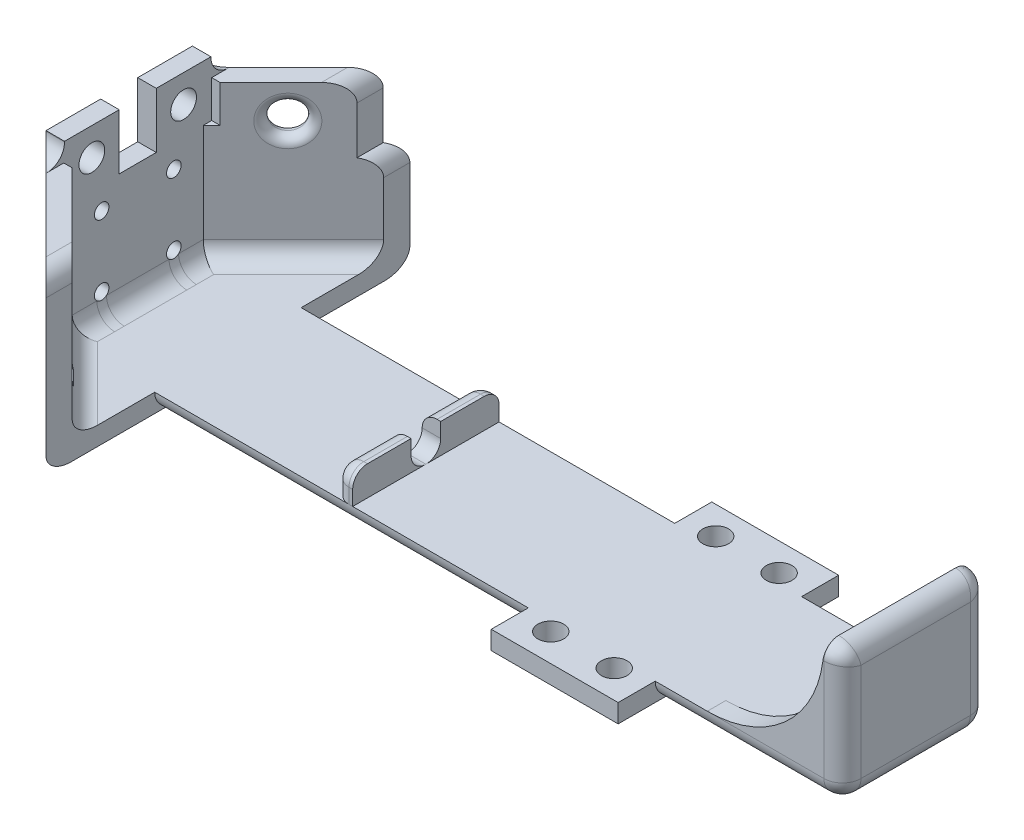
SolidWorks part; units mm, degrees
ref_plane "Front Plane" through (0, 0, 0) normal (0, 0, 1) x (1, 0, 0)
ref_plane "Top Plane" through (0, 0, 0) normal (0, 1, 0) x (1, 0, 0)
ref_plane "Right Plane" through (0, 0, 0) normal (1, 0, 0) x (0, 0, -1)
sketch "Sketch1" plane through (0, 0, 0) normal (0, 1, 0) x (1, 0, 0)
  line L1 (-68.2538, 12.5476) -> (68.2538, 12.5476)
  line L2 (-68.2538, 12.5476) -> (-68.2538, -12.5476)
  line L3 (-68.2538, -12.5476) -> (68.2538, -12.5476)
  line L4 (68.2538, 12.5476) -> (68.2538, -12.5476)
  line L5 (-68.2538, 12.5476) -> (68.2538, -12.5476) construction
  line L6 (-68.2538, -12.5476) -> (68.2538, 12.5476) construction
  point P0 (0, 0)
  dimension "D1" = 136.5076
  dimension "D2" = 25.0952
extrude "Boss-Extrude1" add sketch "Sketch1" along normal blind 3.175 contours L1 L4 L3 L2
sketch "Sketch5" plane through (0, 3.175, 0) normal (0, 1, 0) x (1, 0, 0)
  line L0 (-68.2538, 12.5476) -> (68.2538, 12.5476) construction
  line L1 (-68.2538, -12.5476) -> (-65.0788, -12.5476)
  line L2 (-68.2538, -12.5476) -> (-68.2538, 12.5476)
  line L3 (-68.2538, 12.5476) -> (-65.0788, 12.5476)
  line L4 (-65.0788, -12.5476) -> (-65.0788, 12.5476)
  dimension "D1" = 3.175
extrude "Boss-Extrude2" add sketch "Sketch5" along normal blind 19.9898
mirror "Mirror1" about plane through (0, 0, 0) normal (1, 0, 0) of "Boss-Extrude2"
sketch "Sketch6" plane through (-68.2538, 0, 0) normal (-1, 0, 0) x (0, 0, 1)
  line L0 (-12.5476, 23.1648) -> (12.5476, 23.1648) construction
  line L1 (-12.5476, 23.1648) -> (-12.5476, 0) construction
  line L2 (12.5476, 23.1648) -> (12.5476, 0) construction
  circle A0 centre (-6.1849, 19.1648) radius 1.2497
  circle A1 centre (6.1849, 19.1648) radius 1.2497
  circle A2 centre (6.1849, 7.1648) radius 1.2497
  circle A3 centre (-6.1849, 7.1648) radius 1.2497
  dimension "D9" = 2.4994
  dimension "D3" = 4
  dimension "D4" = 4
  dimension "D5" = 6.3627
  dimension "D6" = 6.3627
  dimension "D7" = 6.3627
  dimension "D8" = 12
  dimension "D1" = 2
  dimension "D2" = 2
extrude "Cut-Extrude1" cut sketch "Sketch6" against normal up to next
sketch "Sketch8" plane through (0, 0, 12.5476) normal (0, 0, 1) x (1, 0, 0)
  line L0 (68.2538, 19.7891) -> (25.2846, 19.7891) construction
  line L1 (68.2538, 23.1648) -> (68.2538, 0) construction
  line L2 (25.2846, 0) -> (25.2846, 19.7891) construction
  line L3 (-68.2538, 0) -> (68.2538, 0) construction
  dimension "D1" = 42.9692
  dimension "D2" = 19.7891
sketch "Sketch9" plane through (0, 0, -12.5476) normal (0, 0, -1) x (-1, 0, 0)
  line L0 (-68.2538, 19.7891) -> (-25.2846, 19.7891) construction
  line L1 (-25.2846, 0) -> (-25.2846, 19.7891) construction
  line L2 (-68.2538, 19.7891) -> (-25.2846, 19.7891) construction
  line L3 (-25.2846, 0) -> (-25.2846, 19.7891) construction
sketch "Sketch10" plane through (0, 0, 12.5476) normal (0, 0, 1) x (1, 0, 0)
  line L0 (-68.2538, 0) -> (68.2538, 0) construction
  line L1 (14.4096, 0) -> (36.1596, 0)
  line L2 (14.4096, 0) -> (14.4096, 3.175)
  line L3 (14.4096, 3.175) -> (36.1596, 3.175)
  line L4 (36.1596, 0) -> (36.1596, 3.175)
  line L5 (-65.0788, 3.175) -> (65.0788, 3.175) construction
  point P8 (25.2846, 0)
  dimension "D1" = 21.75
ref_plane "Plane1" through (0, 0, 0) normal (0, 0, 1) x (1, 0, 0)
extrude "Boss-Extrude5" add sketch "Sketch10" along normal blind 6.35
sketch "Sketch13" plane through (0, 3.175, 0) normal (0, 1, 0) x (1, 0, 0)
  line L0 (36.1596, -18.8976) -> (14.4096, -18.8976) construction
  line L1 (14.4096, -18.8976) -> (14.4096, -12.5476) construction
  circle A0 centre (19.8471, -14.1351) radius 2.2098
  circle A1 centre (30.7221, -14.1351) radius 2.2098
extrude "Cut-Extrude3" cut sketch "Sketch13" against normal through all
mirror "Mirror4" about plane through (0, 0, 0) normal (0, 0, 1) of "Boss-Extrude5", "Cut-Extrude3"
sketch "Sketch16" plane through (0, 0, -12.5476) normal (0, 0, -1) x (-1, 0, 0)
  line L0 (-36.1596, 3.175) -> (-65.0788, 3.175) construction
  line L1 (-65.0788, 23.1648) -> (-65.0788, 3.175) construction
  line L2 (-45.089, 3.175) -> (-65.0788, 3.175)
  line L3 (-65.0788, 23.1648) -> (-65.0788, 3.175)
  arc A0 (-65.0788, 23.1648) -> (-45.089, 3.175) centre (-45.089, 23.1648) ccw
extrude "Boss-Extrude6" add sketch "Sketch16" against normal blind 3.175
mirror "Mirror5" about plane through (0, 0, 0) normal (0, 0, 1) of "Boss-Extrude6"
sketch "Sketch17" plane through (0, 3.175, 0) normal (0, 1, 0) x (1, 0, 0)
  line L0 (-65.0788, -12.5476) -> (14.4096, -12.5476) construction
  line L1 (-15.6912, -12.5476) -> (-18.8662, -12.5476)
  line L2 (-15.6912, -12.5476) -> (-15.6912, -2.54)
  line L3 (-15.6912, 12.5476) -> (-18.8662, 12.5476)
  line L4 (-18.8662, -12.5476) -> (-18.8662, -2.54)
  line L5 (-65.0788, 12.5476) -> (14.4096, 12.5476) construction
  line L6 (-18.8662, 2.54) -> (-18.8662, 12.5476)
  line L7 (-18.8662, -2.54) -> (-15.6912, -2.54)
  line L9 (-18.8662, 2.54) -> (-15.6912, 2.54)
  line L11 (-15.6912, 2.54) -> (-15.6912, 12.5476)
  dimension "D1" = 3.175
  dimension "D2" = 80.77
  dimension "D3" = 5.08
extrude "Boss-Extrude7" add sketch "Sketch17" along normal blind 5.08 contours L6 L3 L11 L9 | L4 L7 L2 L1
fillet "Fillet3" radius 2.54 10 edges at (66.6663, 23.1648, -12.5476) (66.6663, 23.1648, 12.5476) (-17.2787, 8.255, 12.5476) (-17.2787, 3.175, -2.54) (-17.2787, 3.175, 2.54) (-17.2787, 8.255, -12.5476) (-18.8662, 5.715, -12.5476) (-18.8662, 5.715, 12.5476) (-18.8662, 8.255, -7.5438) (-18.8662, 8.255, 7.5438)
sketch "Sketch18" plane through (0, 23.1648, 0) normal (0, 1, 0) x (1, 0, 0)
  line L0 (-68.2538, 12.5476) -> (-68.2538, -12.5476) construction
  line L1 (-65.0788, 12.5476) -> (-68.2538, 12.5476)
  line L2 (-65.0788, 12.5476) -> (-65.0788, 3.175)
  line L3 (-65.0788, 3.175) -> (-68.2538, 3.175)
  line L4 (-68.2538, 12.5476) -> (-68.2538, 3.175)
  line L6 (-65.0788, -12.5476) -> (-68.2538, -12.5476)
  line L7 (-65.0788, -12.5476) -> (-65.0788, -3.175)
  line L8 (-65.0788, -3.175) -> (-68.2538, -3.175)
  line L9 (-68.2538, -12.5476) -> (-68.2538, -3.175)
  point P12 (-66.6663, -3.175)
  dimension "D1" = 6.35
extrude "Boss-Extrude8" add sketch "Sketch18" along normal blind 9.525
sketch "Sketch19" plane through (-68.2538, 0, 0) normal (-1, 0, 0) x (0, 0, 1)
  line L0 (-3.175, 32.6898) -> (-3.175, 23.1648) construction
  line L1 (-12.5476, 32.6898) -> (-3.175, 32.6898) construction
  line L2 (3.175, 32.6898) -> (12.5476, 32.6898) construction
  circle A0 centre (-7.8613, 27.9273) radius 2.2098
  circle A1 centre (7.8613, 27.9273) radius 2.2098
  point P7 (-3.175, 27.9273)
  point P11 (-7.8613, 32.6898)
  point P15 (7.8613, 32.6898)
  dimension "D1" = 4.4196
extrude "Cut-Extrude4" cut sketch "Sketch19" against normal up to next
sketch "Sketch22" plane through (0, 0, 0) normal (0, -1, 0) x (1, 0, 0)
  line L0 (-68.2538, -12.5476) -> (-49.6187, -31.1827)
  line L1 (-49.6187, -31.1827) -> (-49.6187, -12.5476)
  line L2 (-68.2538, -12.5476) -> (14.4096, -12.5476) construction
  line L3 (-68.2538, -12.5476) -> (-49.6187, -12.5476)
  dimension "D1" = 26.354
extrude "Boss-Extrude9" add sketch "Sketch22" against normal blind 3.175
sketch "Sketch24" plane through (0, 3.175, 0) normal (0, 1, 0) x (1, 0, 0)
  line L0 (-68.2538, 12.5476) -> (-49.6187, 31.1827) construction
  line L1 (-68.2538, 12.5476) -> (-49.6187, 31.1827)
  line L2 (-65.0788, 11.2325) -> (-49.6187, 26.6926)
  line L3 (-49.6187, 31.1827) -> (-49.6187, 12.5476) construction
  line L4 (-65.0788, 12.5476) -> (-68.2538, 12.5476) construction
  line L5 (-65.0788, -12.5476) -> (-65.0788, 12.5476) construction
  line L6 (-49.6187, 31.1827) -> (-49.6187, 26.6926)
  line L7 (-65.0788, 12.5476) -> (-68.2538, 12.5476)
  line L8 (-65.0788, 11.2325) -> (-65.0788, 12.5476)
  line L9 (-66.0087, 10.3025) -> (-47.3736, 28.9376) construction
  dimension "D1" = 3.175
extrude "Boss-Extrude10" add sketch "Sketch24" along normal blind 26.354
sketch "Sketch29" plane through (0, 29.529, 0) normal (0, 1, 0) x (1, 0, 0)
  line L0 (-65.0788, 12.5476) -> (-63.7637, 12.5476)
  line L5 (-68.2538, 12.5476) -> (-65.0788, 12.5476)
  line L6 (-65.0788, 12.5476) -> (-65.0788, 11.2325)
  line L7 (-65.0788, 11.2325) -> (-49.6187, 26.6926)
  line L8 (-49.6187, 26.6926) -> (-49.6187, 31.1827)
  line L9 (-49.6187, 31.1827) -> (-68.2538, 12.5476)
  line L11 (-65.0788, 12.5476) -> (-65.0788, 11.2325)
  line L12 (-65.0788, 11.2325) -> (-63.7637, 12.5476)
  dimension "D1" = 0
extrude "Cut-Extrude7" cut sketch "Sketch29" against normal up to surface (6.3642 mm away)
mirror "Mirror6" about plane through (0, 0, 0) normal (0, 0, 1) of "Cut-Extrude7", "Boss-Extrude10", "Boss-Extrude9"
sketch "Sketch27" plane through (-40.4007, 0, 40.4007) normal (-0.7071, 0, 0.7071) x (0.7071, 0, 0.7071)
  line L0 (-13.0362, 29.529) -> (-39.3902, 29.529) construction
  line L1 (-16.2112, 29.529) -> (-16.2112, 3.175) construction
  line L2 (-36.1515, 15.225) -> (-37.4055, 15.225)
  line L4 (-36.1515, 17.479) -> (-37.4055, 17.479)
  line L5 (-37.4055, 15.225) -> (-37.4055, 17.479)
  line L6 (-28.0402, 26.1857) -> (-28.0402, 27.354)
  line L7 (-28.0402, 27.354) -> (-24.3862, 27.354)
  line L8 (-24.3862, 26.1857) -> (-24.3862, 27.354)
  line L10 (-28.0402, 6.5183) -> (-28.0402, 5.35)
  line L11 (-28.0402, 5.35) -> (-24.3862, 5.35)
  line L12 (-24.3862, 6.5183) -> (-24.3862, 5.35)
  arc A0 (-36.1515, 15.225) -> (-28.0402, 6.5183) centre (-26.2132, 16.352) ccw
  circle A1 centre (-26.2132, 16.352) radius 11.002 construction
  arc A2 (-28.0402, 26.1857) -> (-36.1515, 17.479) centre (-26.2132, 16.352) ccw
  arc A3 (-24.3862, 6.5183) -> (-24.3862, 26.1857) centre (-26.2132, 16.352) ccw
  point P5 (-26.2132, 29.529)
  point P23 (-16.2112, 16.352)
extrude "Cut-Extrude6" cut sketch "Sketch27" against normal up to next
sketch "Sketch30" plane through (0, 29.529, 0) normal (0, 1, 0) x (1, 0, 0)
  line L0 (-51.9047, 24.4066) -> (-51.9047, 28.8967)
  line L5 (-65.0788, 12.5476) -> (-63.7637, 12.5476)
  line L6 (-63.7637, 12.5476) -> (-49.6187, 26.6926)
  line L7 (-49.6187, 26.6926) -> (-49.6187, 31.1827)
  line L8 (-49.6187, 31.1827) -> (-68.2538, 12.5476)
  line L9 (-68.2538, 12.5476) -> (-65.0788, 12.5476)
  line L11 (-51.9047, 24.4066) -> (-49.6187, 26.6926)
  line L12 (-49.6187, 26.6926) -> (-49.6187, 31.1827)
  line L13 (-49.6187, 31.1827) -> (-51.9047, 28.8967)
  point P7 (-51.9047, 26.6516)
  dimension "D2" = 2.286
  dimension "D1" = 0
extrude "Cut-Extrude8" cut sketch "Sketch30" against normal blind 11.176
sketch "Sketch31" plane through (-40.4007, 0, -40.4007) normal (-0.7071, 0, -0.7071) x (-0.7071, 0, 0.7071)
  line L0 (16.2691, 29.529) -> (39.3902, 29.529) construction
  circle A0 centre (27.8297, 23.814) radius 2.54
  point P5 (27.8297, 29.529)
  dimension "D1" = 5.08
  dimension "D2" = 5.715
extrude "Cut-Extrude9" cut sketch "Sketch31" against normal up to next
fillet "Fillet5" radius 3.048 14 edges at (-58.9363, 0, -21.8651) (-57.3488, 3.175, -18.9625) (-66.6663, 29.529, -12.5476) (-58.9363, 0, 21.8651) (-65.0788, 3.175, 0) (-66.6663, 29.529, 12.5476) (-49.6187, 29.529, 28.9376) (-57.3488, 3.175, 18.9625) (-56.6912, 5.35, 19.6201) (-50.7617, 18.353, -25.5496) (-50.7617, 18.353, -30.0397) (-49.6187, 18.353, -28.9376) (-51.9047, 29.529, -26.6516) (-68.2538, 0, 0)
fillet "Fillet6" radius 1.5875 2 edges at (-59.6302, 23.814, -16.681) (-61.8753, 23.814, -18.9261)
fillet "Fillet7" radius 3.175 18 edges at (68.2538, 10.3124, -12.5476) (68.2538, 23.1648, 0) (68.2538, 10.3124, 12.5476) (68.2538, 22.4209, 11.8037) (68.2538, 22.4209, -11.8037) (66.6663, 23.1648, 10.0076) (66.6663, 23.1648, -10.0076) (-17.6045, 0, -12.5476) (-49.6187, 1.5875, -12.5476) (-17.6045, 0, 12.5476) (-49.6187, 1.5875, 12.5476) (68.2538, 0, 0) (52.2067, 0, 12.5476) (14.4096, 1.5875, 12.5476) (36.1596, 1.5875, 12.5476) (52.2067, 0, -12.5476) (14.4096, 1.5875, -12.5476) (36.1596, 1.5875, -12.5476)
sketch "Sketch32" plane through (0, 0, -12.5476) normal (0, 0, 1) x (1, 0, 0)
  line L0 (-63.7637, 29.529) -> (-65.0788, 29.529) construction
  line L1 (-65.0788, 23.1648) -> (-62.7928, 23.1648)
  line L2 (-65.0788, 23.1648) -> (-65.0788, 29.529)
  line L3 (-65.0788, 29.529) -> (-62.7928, 29.529)
  line L4 (-62.7928, 23.1648) -> (-62.7928, 29.529)
  dimension "D1" = 2.286
extrude "Cut-Extrude10" cut sketch "Sketch32" against normal blind 0.127
mirror "Mirror7" about plane through (0, 0, 0) normal (0, 0, 1) of "Cut-Extrude10"
equation "\"D4@Sketch13\"=\"D3@Sketch13\"/2"
equation "\"D8@Sketch27\"=\"D7@Sketch27\""
equation "\"D9@Sketch27\"=\"D7@Sketch27\""
equation "\"D10@Sketch27\"=\"D7@Sketch27\""
